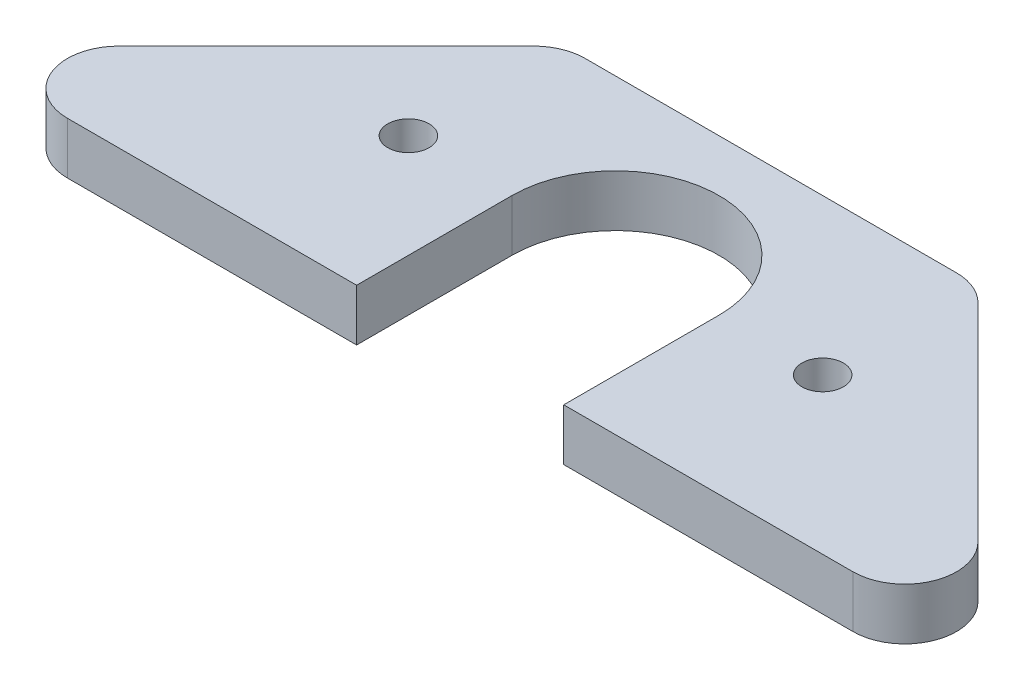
SolidWorks part; units mm, degrees
ref_plane "Front Plane" through (0, 0, 0) normal (0, 0, 1) x (1, 0, 0)
ref_plane "Top Plane" through (0, 0, 0) normal (0, 1, 0) x (1, 0, 0)
ref_plane "Right Plane" through (0, 0, 0) normal (1, 0, 0) x (0, 0, -1)
sketch "Sketch1" plane through (0, 0, 0) normal (0, 1, 0) x (1, 0, 0)
  line L0 (-10, 0) -> (-10, -15)
  line L1 (-10, -15) -> (-50, -15)
  line L2 (-50, -15) -> (-20, 15)
  line L3 (-20, 15) -> (20, 15)
  line L4 (0, -879.853) -> (0, 43112.799) construction
  line L5 (50, -15) -> (20, 15)
  line L6 (10, -15) -> (50, -15)
  line L7 (10, 0) -> (10, -15)
  arc A0 (10, 0) -> (-10, 0) centre (0, 0) ccw
  circle A1 centre (-20, 0) radius 2
  circle A2 centre (20, 0) radius 2
  point P11 (0, 15)
  dimension "D1" = 10
  dimension "D6" = 4
  dimension "D2" = 15
  dimension "D3" = 40
  dimension "D4" = 90
  dimension "D5" = 30
extrude "Boss-Extrude1" add sketch "Sketch1" along normal blind 5
fillet "Fillet1" radius 5 4 edges at (20, 2.5, -15) (-20, 2.5, -15) (50, 2.5, 15) (-50, 2.5, 15)
